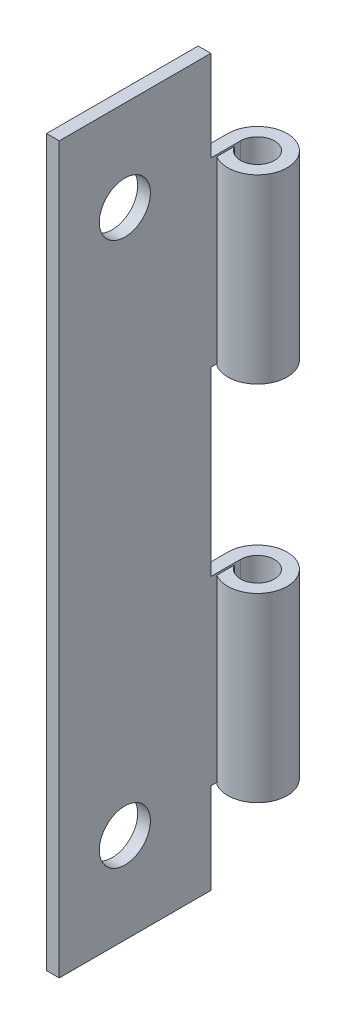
SolidWorks part; units mm, degrees
ref_plane "Front Plane" through (0, 0, 0) normal (0, 0, 1) x (1, 0, 0)
ref_plane "Top Plane" through (0, 0, 0) normal (0, 1, 0) x (1, 0, 0)
ref_plane "Right Plane" through (0, 0, 0) normal (1, 0, 0) x (0, 0, -1)
sketch "Sketch1" plane through (0, 0, 0) normal (1, 0, 0) x (0, 0, -1)
  line L0 (0, 0) -> (0, 50.8) construction
  line L1 (0, 0) -> (12.7, 0) construction
  line L2 (6.3119, 6.35) -> (9.8933, 6.35) construction
  line L3 (0, 0) -> (-12.7, 0) construction
  point P3 (8.1026, 6.35)
  point P5 (8.1026, 44.45)
  point P6 (0, 6.35)
  point P9 (-101.6, 50.8)
  point P10 (8.1026, 6.35)
  point P11 (-50.8, 50.8)
  point P12 (-203.2, 50.8)
  point P13 (-8.1026, 44.45)
  point P14 (-8.1026, 6.35)
sketch "Sketch2" plane through (0, 0, 0) normal (0, 1, 0) x (1, 0, 0)
  line L0 (0.889, 0) -> (3.2703, 0) construction
  line L1 (0, 12.7) -> (0.889, 12.7) construction
  line L2 (-0.889, 10.4616) -> (0, 10.4616) construction
  line L3 (2.0796, 1.1906) -> (2.0796, 2.0796) construction
  line L5 (2.0796, 2.0796) -> (2.0796, 10.4616) construction
  circle A0 centre (2.0796, 0) radius 1.1906 construction
  point P9 (2.0796, 1.1906)
  point P10 (1.016, 10.4616)
sketch "Sketch3" plane through (0, 0, 0) normal (0, 1, 0) x (1, 0, 0)
  line L0 (0.889, 12.7) -> (0, 12.7)
  line L1 (0, 12.7) -> (0, 0)
  line L2 (0, 0) -> (0, 12.7) construction
  line L3 (0.889, 12.7) -> (0.889, 0)
  line L4 (1.016, 1.787) -> (1.016, 0.5351)
  arc A0 (0, 0) -> (1.016, 1.787) centre (2.0796, 0) ccw
  arc A1 (0.889, 0) -> (1.016, 0.5351) centre (2.0796, 0) ccw
sketch "Sketch4" plane through (0, 0, 0) normal (0, 1, 0) x (1, 0, 0)
  line L0 (0, 0) -> (0, -12.7)
  line L1 (0, -12.7) -> (0.889, -12.7)
  line L2 (0.889, -12.7) -> (0.889, 0)
  line L3 (1.016, -0.5351) -> (1.016, -1.787)
  line L4 (0.889, 0) -> (3.2703, 0) construction
  line L5 (0, 0) -> (0, 12.7) construction
  arc A0 (1.016, -1.787) -> (0, 0) centre (2.0796, 0) ccw
  arc A1 (1.016, -0.5351) -> (0.889, 0) centre (2.0796, 0) ccw
extrude "Boss-Extrude2" add sketch "Sketch4" along normal up to vertex (50.8 mm away) separate body
sketch "Sketch16" plane through (0, 0, 0) normal (1, 0, 0) x (0, 0, -1)
  line L0 (2.0796, 0) -> (2.0796, 50.8) construction
  line L1 (-2.0796, 50.8) -> (2.0796, 50.8)
  line L2 (-2.0796, 50.8) -> (-2.0796, 44.45)
  line L3 (-2.0796, 44.45) -> (2.0796, 44.45)
  line L4 (2.0796, 50.8) -> (2.0796, 44.45)
  line L5 (-2.0796, 50.8) -> (-2.0796, 0) construction
  line L6 (-2.0796, 0) -> (2.0796, 0)
  line L7 (-2.0796, 0) -> (-2.0796, 6.35)
  line L8 (-2.0796, 6.35) -> (2.0796, 6.35)
  line L9 (2.0796, 0) -> (2.0796, 6.35)
  line L10 (-2.0796, 31.75) -> (2.0796, 31.75)
  line L11 (-2.0796, 31.75) -> (-2.0796, 19.05)
  line L12 (-2.0796, 19.05) -> (2.0796, 19.05)
  line L13 (2.0796, 31.75) -> (2.0796, 19.05)
  line L14 (-12.7, 0) -> (0, 0) construction
  dimension "D1" = 6.35
  dimension "D2" = 12.7
  dimension "D3" = 6.35
  dimension "D4" = 19.05
sketch "Sketch7" plane through (0, 0, 0) normal (1, 0, 0) x (0, 0, -1)
  line L0 (-2.5876, 38.1) -> (2.5876, 38.1)
  line L1 (-2.5876, 12.7) -> (2.5876, 12.7)
  line L2 (-2.5876, 12.7) -> (-2.5876, 6.35)
  line L3 (-2.5876, 6.35) -> (2.5876, 6.35)
  line L4 (2.5876, 12.7) -> (2.5876, 6.35)
  line L5 (-2.5876, 25.4) -> (2.5876, 25.4)
  line L6 (-2.5876, 25.4) -> (-2.5876, 19.05)
  line L7 (2.5876, 25.4) -> (2.5876, 19.05)
  line L8 (-2.5876, 19.05) -> (2.5876, 19.05)
  line L9 (-2.5876, 12.7) -> (-2.5876, 25.4) construction
  line L10 (-2.5876, 38.1) -> (-2.5876, 31.75)
  line L11 (2.5876, 38.1) -> (2.5876, 31.75)
  line L12 (-2.5876, 31.75) -> (2.5876, 31.75)
  line L13 (-2.5876, 50.8) -> (2.5876, 50.8)
  line L14 (-2.5876, 50.8) -> (-2.5876, 44.45)
  line L15 (2.5876, 50.8) -> (2.5876, 44.45)
  line L16 (-2.5876, 44.45) -> (2.5876, 44.45)
  line L17 (-2.5876, 63.5) -> (2.5876, 63.5)
  line L18 (-2.5876, 63.5) -> (-2.5876, 57.15)
  line L19 (2.5876, 63.5) -> (2.5876, 57.15)
  line L20 (-2.5876, 57.15) -> (2.5876, 57.15)
  point P5 (0, 6.35)
extrude "Cut-Extrude7" cut sketch "Sketch16" along normal through all
sketch "Sketch18" plane through (0.889, 0, 0) normal (1, 0, 0) x (0, 0, -1)
  line L0 (0, 2.2876) -> (0, -2.2876) construction
  line L1 (-12.7, 0) -> (-2.0796, 0) construction
  circle A0 centre (-8.1026, 6.35) radius 1.7907
  dimension "D1" = 3.5814
  dimension "D2" = 8.1026
  dimension "D3" = 6.35
extrude "Cut-Extrude8" cut sketch "Sketch18" against normal through all
ref_plane "Plane1" through (0, 25.4, 0) normal (0, 1, 0) x (1, 0, 0)
mirror "Mirror1" about plane through (0, 25.4, 0) normal (0, 1, 0) of "Cut-Extrude8"
equation "\"Num Knuckles\"=5"
equation "\"D1@Sketch7\"=\"Knuckle Length@Sketch1\""
equation "\"D2@Sketch7\" = ( 2 * \"Leaf Thickness@Sketch2\" ) + \"Pin Dia@Sketch2\" + ( .04 * \"Overall Width@Sketch1\" )"
equation "\"D4@Sketch7\"=\"Knuckle Length@Sketch1\"*2"
equation "\"D3@Sketch7\" = int ( \"Num Knuckles@Sketch1\" / 2 )  + 1"
equation "\"Spring Knuckles\"= 1"
equation "\"Num Holes\"=4"
equation "\"D1@Sketch1\"= \"Length Corner@Sketch1\""
equation "\"D1@Sketch2\"= \"Wire Dia@Sketch2\""
equation "\"Knuckle Length@Sketch1\"=\"Leaf Height@Sketch1\"/\"Num Knuckles@Sketch1\""
equation "\"D2@Sketch1\"=\"Height Corner@Sketch1\""
equation "\"D4@Sketch1\" = \"Length Corner 2@Sketch1\""
